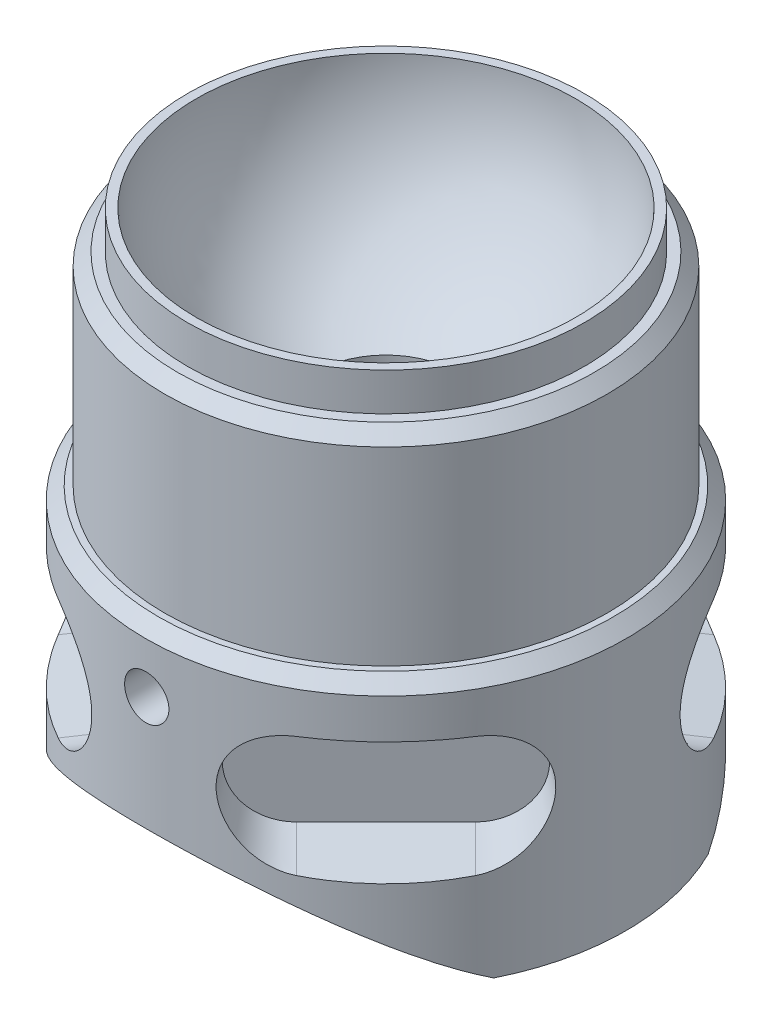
SolidWorks part; units mm, degrees
ref_plane "Anteriore" through (0, 0, 0) normal (0, 0, 1) x (1, 0, 0)
ref_plane "Superiore" through (0, 0, 0) normal (0, 1, 0) x (1, 0, 0)
ref_plane "Destro" through (0, 0, 0) normal (1, 0, 0) x (0, 0, -1)
sketch "Schizzo1" plane through (0, 0, 0) normal (0, 1, 0) x (1, 0, 0)
  circle A0 centre (0, 0) radius 19
  dimension "D1" = 38
extrude "Estrusione1" add sketch "Schizzo1" along normal blind 40
sketch "Schizzo2" plane through (0, 40, 0) normal (0, 1, 0) x (-1, 0, 0)
  circle A0 centre (0, 0) radius 5.5
  dimension "D1" = 11
extrude "Taglio-Estrusione1" cut sketch "Schizzo2" against normal through all
sketch "Schizzo3" plane through (0, 0, 0) normal (0, 0, 1) x (1, 0, 0)
  line L1 (0, 55) -> (0, 25)
  line L3 (19, 40) -> (-19, 40) construction
  arc A0 (0, 25) -> (0, 55) centre (0, 40) ccw
  dimension "D1" = 30
revolve "Taglia-Rivoluzione1" cut sketch "Schizzo3" angle 360 about axis through (0, 40, 0) along (0, -1, 0)
sketch "Schizzo4" plane through (0, 40, 0) normal (0, 1, 0) x (-1, 0, 0)
  circle A1 centre (0, 0) radius 25.7
  circle A2 centre (0, 0) radius 15.7
  circle A3 centre (0, 0) radius 15.7
  dimension "D1" = 0.7
  dimension "D2" = 10
extrude "Taglio-Estrusione2" cut sketch "Schizzo4" against normal blind 3
sketch "Schizzo5" plane through (0, 37, 0) normal (0, 1, 0) x (-1, 0, 0)
  circle A0 centre (0, 0) radius 17.5
  circle A1 centre (0, 0) radius 27.5
  dimension "D1" = 35
  dimension "D2" = 10
extrude "Taglio-Estrusione3" cut sketch "Schizzo5" against normal blind 16
sketch "Schizzo6" plane through (0, 0, 0) normal (0, -1, 0) x (1, 0, 0)
  circle A1 centre (0, 0) radius 7.25
  circle A2 centre (0, 0) radius 12
  dimension "D1" = 14.5
  dimension "D2" = 24
extrude "Taglio-Estrusione4" cut sketch "Schizzo6" against normal blind 11
sketch "Schizzo7" plane through (0, 0, 0) normal (0, 0, 1) x (1, 0, 0)
  line L0 (-12, 7) -> (9, 7) construction
  line L1 (-19, 0) -> (19, 0) construction
  line L2 (0, 21) -> (0, 0) construction
  circle A0 centre (0, -17.15) radius 24.15
  dimension "D1" = 48.3
  dimension "D2" = 7
extrude "Taglio-Estrusione5" cut sketch "Schizzo7" against normal through all and the other way through all
sketch "Schizzo8" plane through (0, 0, 0) normal (0, 1, 0) x (1, 0, 0)
  circle A0 centre (0, 0) radius 5.5 construction
  circle A1 centre (0, 0) radius 7.25
  circle A2 centre (0, 0) radius 7.25
  circle A3 centre (0, 0) radius 5.5
  dimension "D1" = 0
extrude "Estrusione2" add sketch "Schizzo8" along normal up to surface (7 mm away)
ref_plane "Piano1" through (0, 0, 0) normal (0.7071, 0, 0.7071) x (0.7071, 0, -0.7071)
ref_plane "Piano2" through (14.1421, 0, 14.1421) normal (0.7071, 0, 0.7071) x (0.7071, 0, -0.7071)
sketch "Schizzo9" plane through (14.1421, 0, 14.1421) normal (0.7071, 0, 0.7071) x (0.7071, 0, -0.7071)
  line L0 (-5, 17) -> (5, 17)
  line L1 (5, 7) -> (-5, 7)
  line L5 (0, 21) -> (0, 0) construction
  line L6 (19, 21) -> (-19, 21) construction
  arc A0 (5, 17) -> (5, 7) centre (5, 12) cw
  arc A1 (-5, 7) -> (-5, 17) centre (-5, 12) cw
  point P6 (0, 7)
  dimension "D1" = 10
  dimension "D2" = 10
  dimension "D3" = 4
extrude "Taglio-Estrusione6" cut sketch "Schizzo9" against normal blind 6 draft 8
pattern_circular "RipetizioneCircolare1" count 4 over 360 about axis through (0, 0, 0) along (0, 1, 0) of "Taglio-Estrusione6"
ref_plane "Piano4" through (0, 0, -25) normal (0, 0, 1) x (1, 0, 0)
sketch "Schizzo10" plane through (0, 0, -25) normal (0, 0, 1) x (1, 0, 0)
  line L0 (0, 21) -> (0, 0) construction
  line L1 (19, 21) -> (-19, 21) construction
  circle A0 centre (0, 16) radius 1.75
  dimension "D1" = 3.5
  dimension "D2" = 5
extrude "Taglio-Estrusione7" cut sketch "Schizzo10" along normal blind 17
chamfer "Smusso1" distance 1 angle 45 2 edges at (0, 37, 17.5) (0, 21, 19)
mirror "Specchia3" about plane through (0, 0, 0) normal (0, 0, 1) of "Taglio-Estrusione7"
